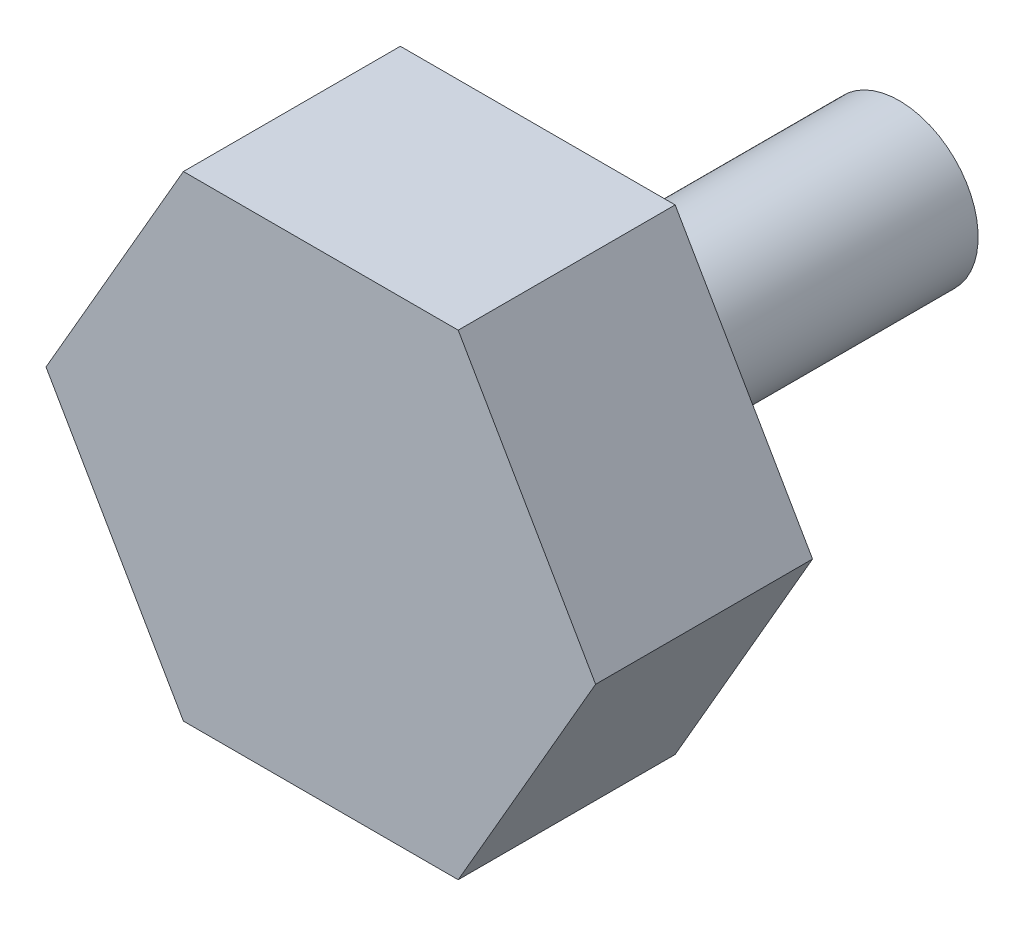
SolidWorks part; units mm, degrees
ref_plane "Front Plane" through (0, 0, 0) normal (0, 0, 1) x (1, 0, 0)
ref_plane "Top Plane" through (0, 0, 0) normal (0, 1, 0) x (1, 0, 0)
ref_plane "Right Plane" through (0, 0, 0) normal (1, 0, 0) x (0, 0, -1)
sketch "Sketch1" plane through (0, 0, 0) normal (0, 0, 1) x (1, 0, 0)
  line L1 (1.9, -3.2909) -> (3.8, 0)
  line L2 (3.8, 0) -> (1.9, 3.2909)
  line L3 (1.9, 3.2909) -> (-1.9, 3.2909)
  line L4 (-1.9, 3.2909) -> (-3.8, 0)
  line L5 (-3.8, 0) -> (-1.9, -3.2909)
  line L6 (-1.9, -3.2909) -> (1.9, -3.2909)
  circle A0 centre (0, 0) radius 3.2909 construction
  dimension "D1" = 3.8
extrude "Boss-Extrude1" add sketch "Sketch1" along normal blind 3
sketch "Sketch2" plane through (0, 0, 0) normal (0, 0, -1) x (-1, 0, 0)
  circle A0 centre (0, 0) radius 1.09
  dimension "D1" = 2.18
extrude "Boss-Extrude2" add sketch "Sketch2" along normal blind 5
